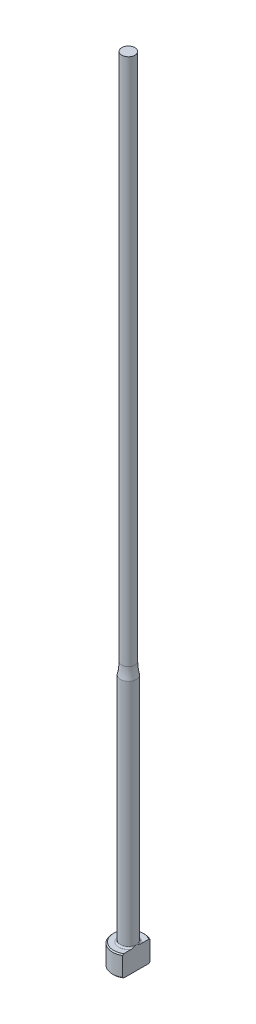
SolidWorks part; units mm, degrees
ref_plane "Front Plane" through (0, 0, 0) normal (0, 0, 1) x (1, 0, 0)
ref_plane "Top Plane" through (0, 0, 0) normal (0, 1, 0) x (1, 0, 0)
ref_plane "Right Plane" through (0, 0, 0) normal (1, 0, 0) x (0, 0, -1)
sketch "Sketch1" plane through (0, 0, 0) normal (0, 0, 1) x (1, 0, 0)
  line L0 (0, 259.9588) -> (0, -15.1925) construction
  line L1 (0, 0) -> (-3, 0)
  line L2 (-3, 0) -> (-3, 4)
  line L3 (-3, 4) -> (-1.5, 4)
  line L4 (-1.25, 50) -> (-1.25, 150)
  line L5 (-1.25, 150) -> (0, 150)
  line L6 (0, 150) -> (0, 0)
  line L7 (-1.5, 4) -> (-1.5, 47.778)
  arc A0 (-1.5, 47.778) -> (-1.25, 50) centre (-11.25, 50) ccw
  point P13 (-1.5, 0)
  dimension "D1" = 10
  dimension "L" = 150
  dimension "H" = 6
  dimension "T" = 4
  dimension "D" = 2.5
  dimension "B" = 3
  dimension "S" = 50
revolve "Revolve1" add sketch "Sketch1" angle 360 about L0
chamfer "Chamfer1" distance 0.2 angle 45 2 edges at (0, 4, 3) (0, 0, 3)
fillet "Fillet1" radius 0.3 1 edges at (0, 4, 1.5)
sketch "Sketch2" plane through (0, 0, 0) normal (0, 1, 0) x (1, 0, 0)
  line L0 (1.5, -2.5981) -> (1.5, 2.5981)
  circle A0 centre (0, 0) radius 3 construction
  arc A1 (1.5, -2.5981) -> (1.5, 2.5981) centre (0, 0) ccw
  circle A2 centre (0, 0) radius 1.5 construction
extrude "Keyed Head" cut sketch "Sketch2" along normal through all
